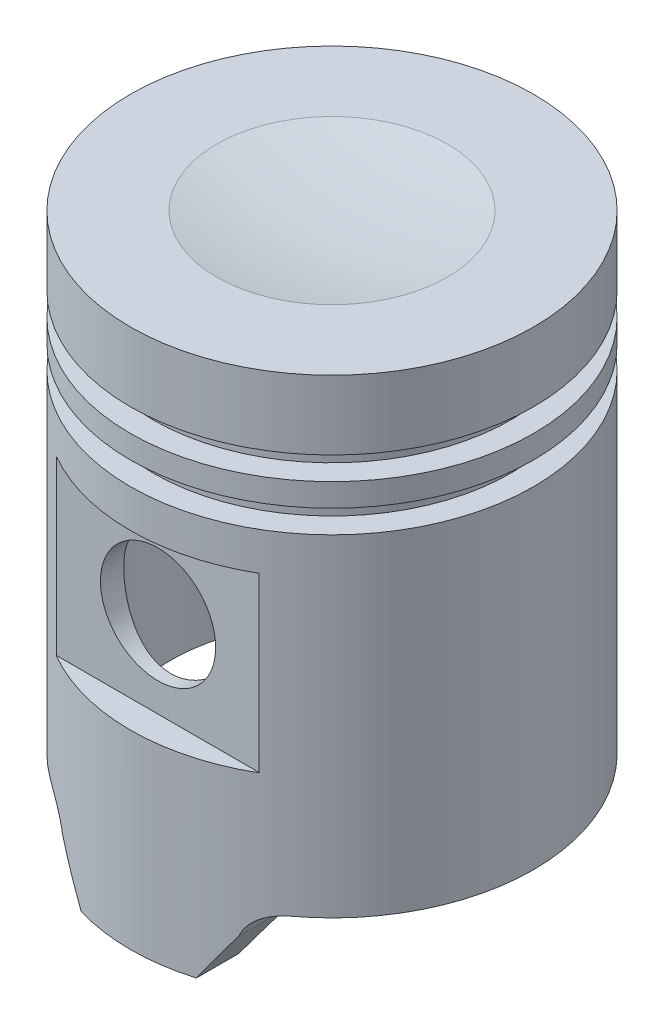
SolidWorks part; units mm, degrees
ref_plane "Front Plane" through (0, 0, 0) normal (0, 0, 1) x (1, 0, 0)
ref_plane "Top Plane" through (0, 0, 0) normal (0, 1, 0) x (1, 0, 0)
ref_plane "Right Plane" through (0, 0, 0) normal (1, 0, 0) x (0, 0, -1)
sketch "Sketch2" plane through (0, 0, 0) normal (1, 0, 0) x (0, 0, -1)
  line L4 (0, 74.5117) -> (0, -77.8883) construction
  line L11 (0, -6.35) -> (17.78, -6.35)
  line L13 (22.225, -58.166) -> (17.78, -58.166)
  line L14 (17.78, -6.35) -> (17.78, -58.166)
  line L16 (19.685, -6.35) -> (19.685, -8.89)
  line L17 (22.225, 1.27) -> (22.225, -6.35)
  line L18 (22.225, -6.35) -> (19.685, -6.35)
  line L19 (19.685, -8.89) -> (22.225, -8.89)
  line L20 (22.225, -8.89) -> (22.225, -11.43)
  line L21 (22.225, -11.43) -> (19.685, -11.43)
  line L22 (19.685, -11.43) -> (19.685, -13.97)
  line L23 (19.685, -13.97) -> (22.225, -13.97)
  line L24 (22.225, -13.97) -> (22.225, -19.431)
  line L29 (22.225, -38.481) -> (22.225, -58.166)
  line L30 (12.7127, 1.27) -> (22.225, 1.27)
  line L31 (0, 0) -> (0, -6.35)
  line L32 (22.225, -19.431) -> (22.225, -38.481)
  arc A1 (0, 0) -> (12.7127, 1.27) centre (0, 64.262) ccw
  dimension "D8" = 64.262
  dimension "D9" = 58.166
  dimension "D3" = 19.05
  dimension "D1" = 12.7127
  dimension "D2" = 17.78
  dimension "D4" = 19.685
  dimension "D5" = 22.225
  dimension "D6" = 6.35
  dimension "D7" = 38.481
revolve "Revolve1" add sketch "Sketch2" angle 360 about L4
ref_plane "Plane1" through (0, 0, 22.225) normal (0, 0, 1) x (1, 0, 0)
sketch "Sketch4" plane through (0, 0, 22.225) normal (0, 0, 1) x (1, 0, 0)
  line L0 (0, 1.27) -> (0, -56.642) construction
  line L1 (12.7127, 1.27) -> (-12.7127, 1.27) construction
  line L2 (-22.225, -58.166) -> (22.225, -58.166) construction
  line L3 (-11.176, -37.211) -> (11.176, -37.211)
  line L4 (-11.176, -37.211) -> (-11.176, -18.161)
  line L5 (-11.176, -18.161) -> (11.176, -18.161)
  line L6 (11.176, -37.211) -> (11.176, -18.161)
  line L7 (-11.176, -37.211) -> (11.176, -18.161) construction
  line L8 (-11.176, -18.161) -> (11.176, -37.211) construction
  point P5 (0, -27.686)
  point P10 (0, 0)
  point P11 (0, 0)
  dimension "D1" = 30.48
  dimension "D2" = 19.05
  dimension "D3" = 22.352
extrude "Cut-Extrude5" cut sketch "Sketch4" against normal blind 3.048
sketch "Sketch5" plane through (0, 0, 19.177) normal (0, 0, 1) x (1, 0, 0)
  line L2 (-22.225, -58.166) -> (22.225, -58.166) construction
  line L3 (11.176, -37.211) -> (11.176, -18.161) construction
  circle A0 centre (0, -27.686) radius 6.35
  point P2 (0, 0)
  dimension "D1" = 30.48
  dimension "D2" = 12.7
  dimension "D3" = 11.176
extrude "Cut-Extrude6" cut sketch "Sketch5" against normal up to surface (2.5696 mm away) contours A0
ref_plane "Plane2" through (0, 0, -22.225) normal (0, 0, -1) x (-1, 0, 0)
sketch "Sketch7" plane through (0, 0, -22.225) normal (0, 0, -1) x (-1, 0, 0)
  line L0 (0, 1.27) -> (0, -64.5597) construction
  line L1 (22.225, 1.27) -> (-22.225, 1.27) construction
  line L2 (-22.225, -58.166) -> (22.225, -58.166) construction
  line L3 (-11.176, -37.211) -> (11.176, -37.211)
  line L4 (-11.176, -37.211) -> (-11.176, -18.161)
  line L5 (-11.176, -18.161) -> (11.176, -18.161)
  line L6 (11.176, -37.211) -> (11.176, -18.161)
  line L7 (-11.176, -37.211) -> (11.176, -18.161) construction
  line L8 (-11.176, -18.161) -> (11.176, -37.211) construction
  point P5 (0, -27.686)
  point P10 (0, 0)
  dimension "D1" = 19.05
  dimension "D2" = 22.352
  dimension "D3" = 30.48
extrude "Cut-Extrude7" cut sketch "Sketch7" against normal blind 3.048 contours L4 L3 L6 L5
sketch "Sketch8" plane through (0, 0, -19.177) normal (0, 0, -1) x (-1, 0, 0)
  line L0 (-22.225, -58.166) -> (22.225, -58.166) construction
  line L1 (11.176, -37.211) -> (11.176, -18.161) construction
  circle A0 centre (0, -27.686) radius 6.35
  dimension "D1" = 30.48
  dimension "D2" = 12.7
  dimension "D3" = 11.176
extrude "Cut-Extrude8" cut sketch "Sketch8" against normal blind 3.048 contours A0
sketch "Sketch10" plane through (0, 0, 22.225) normal (0, 0, 1) x (1, 0, 0)
  line L0 (0, 0) -> (0, -64.5597) construction
  line L1 (-6.35, -58.166) -> (6.35, -58.166)
  line L2 (-22.225, -58.166) -> (22.225, -58.166) construction
  line L3 (-9.7391, -53.0842) -> (-6.35, -58.166)
  line L4 (-13.335, -50.5419) -> (-22.225, -50.5419)
  line L5 (13.335, -50.5419) -> (22.225, -50.5419)
  line L6 (22.225, -58.166) -> (22.225, -13.97) construction
  line L7 (9.7391, -53.0842) -> (6.35, -58.166)
  line L8 (-22.225, -50.5419) -> (-22.225, -58.166)
  line L9 (-22.225, -58.166) -> (22.225, -58.166)
  line L10 (22.225, -58.166) -> (22.225, -50.5419)
  arc A0 (13.335, -50.5419) -> (9.7391, -53.0842) centre (13.335, -54.356) ccw
  arc A1 (-13.335, -50.5419) -> (-9.7391, -53.0842) centre (-13.335, -54.356) cw
  point P11 (0, -58.166)
  dimension "D1" = 3.8141
  dimension "D2" = 3.81
  dimension "D3" = 8.89
  dimension "D4" = 6.35
  dimension "D5" = 9.7391
extrude "Cut-Extrude9" cut sketch "Sketch10" against normal through all and the other way through all contours A1 L4 L8 L9 L3 | L5 A0 L7 L9 L10
